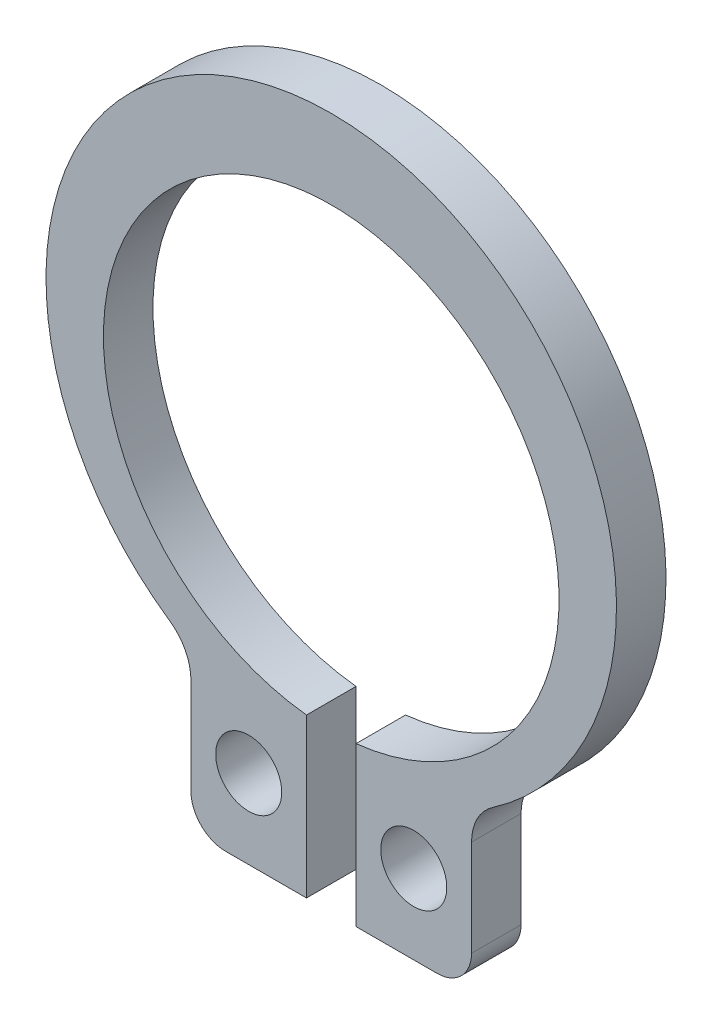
SolidWorks part; units mm, degrees
ref_plane "Front Plane" through (0, 0, 0) normal (0, 0, 1) x (1, 0, 0)
ref_plane "Top Plane" through (0, 0, 0) normal (0, 1, 0) x (1, 0, 0)
ref_plane "Right Plane" through (0, 0, 0) normal (1, 0, 0) x (0, 0, -1)
sketch "BodySke" plane through (0, 0, 0) normal (0, 0, 1) x (1, 0, 0)
  line L0 (0, 0) -> (0, 21.0564) construction
  line L1 (0, 0) -> (0, -11.0385) construction
  line L2 (-0.75, -6.8591) -> (-0.75, -11.6591)
  line L3 (-0.75, -11.6591) -> (-4.25, -11.6591)
  line L4 (-4.25, -11.6591) -> (-4.25, -6.8624)
  line L5 (4.25, -9.2608) -> (3.9811, -9.2608) construction
  line L7 (0.75, -11.6591) -> (4.25, -11.6591)
  line L8 (0.75, -6.8591) -> (0.75, -11.6591)
  line L9 (4.25, -11.6591) -> (4.25, -6.8624)
  arc A0 (0.75, -6.8591) -> (-0.75, -6.8591) centre (0, 0) ccw
  circle A2 centre (-2.5, -9.2608) radius 1
  circle A3 centre (2.5, -9.2608) radius 1
  arc A4 (4.25, -6.8624) -> (-4.25, -6.8624) centre (0, 0.66) ccw
  dimension "D1" = 0.75
  dimension "Groove_Diameter" = 13.8
  dimension "D2" = 0.75
  dimension "D3" = 8.64
  dimension "dia" = 2
  dimension "Groove_Depth" = 2.4
  dimension "Thickness" = 1.5
  dimension "Groove_length" = 4.8
extrude "BaseBody" add sketch "BodySke" along normal blind 1.5
fillet "Fillet1" radius 1.5 2 edges at (4.25, -6.8624, 0.75) (-4.25, -6.8624, 0.75)
fillet "Fillet2" radius 1.05 2 edges at (4.25, -11.6591, 0.75) (-4.25, -11.6591, 0.75)
equation "\"D1@BodySke\" = \"Thickness@BodySke\" / 2"
equation "\"D2@BodySke\" = \"Thickness@BodySke\" / 2"
equation "\"D3@BodySke\" =  ( \"Groove_Diameter@BodySke\" + 1.45 * \"Groove_Depth@BodySke\" )  / 2"
equation "\"Thickness@BaseBody\" = \"Thickness@BodySke\""
equation "\"D1@Fillet1\" = \"Thickness@BodySke\""
equation "\"D1@Fillet2\" = \"Thickness@BodySke\" * 0.7"
